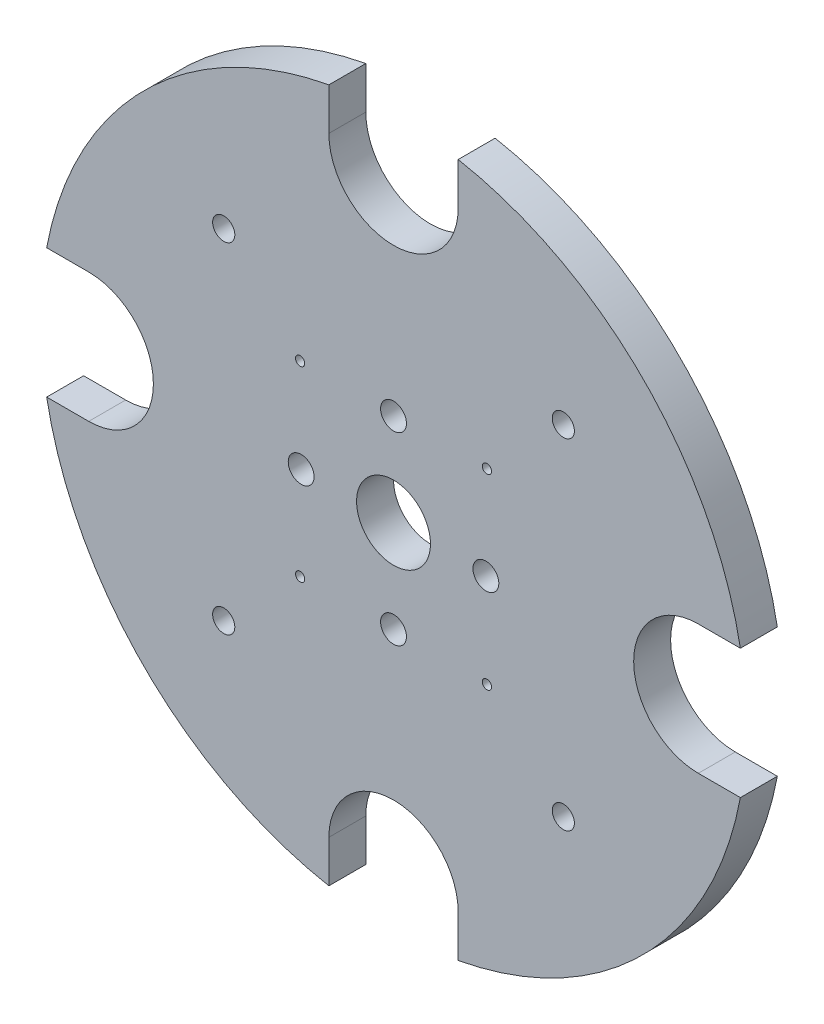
SolidWorks part; units mm, degrees
ref_plane "Plan1" through (0, 0, 0) normal (0, 0, 1) x (1, 0, 0)
ref_plane "Plan2" through (0, 0, 0) normal (0, 1, 0) x (1, 0, 0)
ref_plane "Plan3" through (0, 0, 0) normal (1, 0, 0) x (0, 0, -1)
sketch "Esquisse1" plane through (0, 0, 0) normal (0, 0, 1) x (1, 0, 0)
  line L0 (0, 0) -> (0, 114.126) construction
  line L1 (0, 0) -> (135.1767, 0) construction
  circle A0 centre (0, 0) radius 191
  dimension "D1" = 382
extrude "Base-Extrusion" add sketch "Esquisse1" along normal blind 20
sketch "Esquisse2" plane through (0, 0, 20) normal (0, 0, 1) x (1, 0, 0)
  line L0 (0, 0) -> (0, 205.2109) construction
  line L1 (0, 0) -> (227.442, 0) construction
  circle A0 centre (0, 0) radius 20
  dimension "D1" = 40
extrude "Enlèv. mat.-Extru.1" cut sketch "Esquisse2" against normal blind 20
sketch "Esquisse3" plane through (0, 0, 20) normal (0, 0, 1) x (1, 0, 0)
  circle A0 centre (50, 0) radius 7
  circle A1 centre (0, 0) radius 50 construction
  dimension "D1" = 14
  dimension "D2" = 100
extrude "Enlèv. mat.-Extru.2" cut sketch "Esquisse3" against normal blind 20
pattern_circular "Répétition circulaire1" count 4 every 90
sketch "Esquisse4" plane through (0, 0, 20) normal (0, 0, 1) x (1, 0, 0)
  line L1 (0, 0) -> (237.7026, 0) construction
  line L2 (0, 0) -> (91.9239, 91.9239) construction
  circle A0 centre (91.9239, 91.9239) radius 6
  circle A1 centre (50.5581, 50.5581) radius 2.5
  circle A2 centre (0, 0) radius 71.5 construction
  circle A3 centre (0, 0) radius 130 construction
  dimension "D2" = 12
  dimension "D3" = 5
  dimension "D5" = 143
  dimension "D4" = 260
  dimension "D1" = 45
extrude "Enlèv. mat.-Extru.3" cut sketch "Esquisse4" against normal blind 20
pattern_circular "Répétition circulaire2" count 4 every 90
sketch "Esquisse5" plane through (0, 0, 20) normal (0, 0, 1) x (1, 0, 0)
  line L1 (0, 0) -> (0, 207.263) construction
  line L2 (-35, 187.7658) -> (-35, 165)
  line L4 (35, 165) -> (35, 187.7658)
  circle A0 centre (0, 0) radius 191 construction
  arc A1 (-35, 165) -> (35, 165) centre (0, 165) ccw
  arc A2 (35, 187.7658) -> (-35, 187.7658) centre (0, 0) ccw
  circle A3 centre (0, 0) radius 20 construction
  dimension "D1" = 165
  dimension "D2" = 70
extrude "Enlèv. mat.-Extru.4" cut sketch "Esquisse5" against normal through all
pattern_circular "Répétition circulaire3" count 4 every 90
